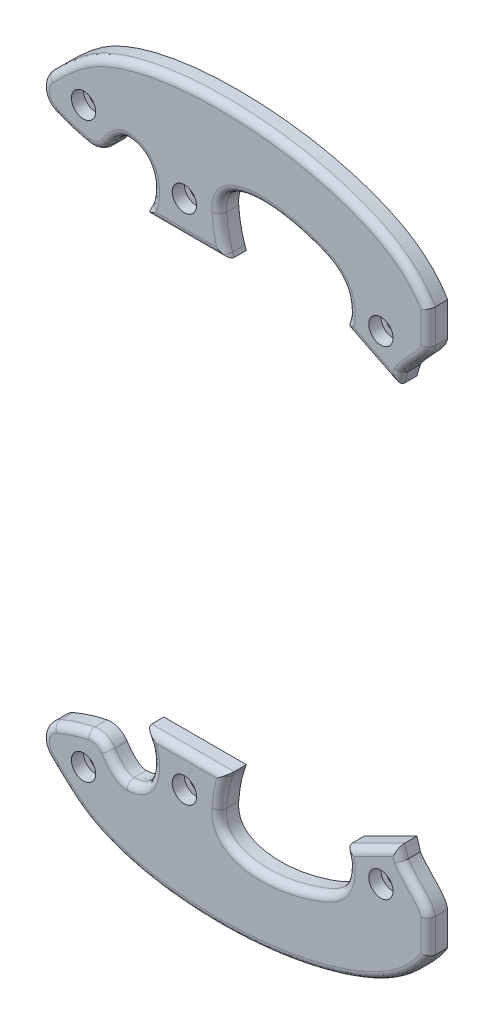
SolidWorks part; units mm, degrees
ref_plane "Front Plane" through (0, 0, 0) normal (0, 0, 1) x (1, 0, 0)
ref_plane "Top Plane" through (0, 0, 0) normal (0, 1, 0) x (1, 0, 0)
ref_plane "Right Plane" through (0, 0, 0) normal (1, 0, 0) x (0, 0, -1)
sketch "Sketch1" plane through (0, 0, 0) normal (0, 0, 1) x (1, 0, 0)
  line L8 (46.2395, -97.188) -> (45.0848, -92.6766)
  line L9 (-4.1958, -93.2842) -> (-3.553, -91.6123)
  line L10 (45.0848, -92.6766) -> (61.7915, -84.3708)
  line L11 (-31.761, -91.6123) -> (-3.553, -91.6123)
  line L12 (-31.761, -91.6123) -> (-37.5102, -91.6123)
  line L13 (-37.5102, -91.6123) -> (-35.1375, -96.6123)
  line L14 (79.2504, -115.4644) -> (79.2504, -101.6424)
  line L15 (68.0435, -86.8465) -> (66.6096, -81.9755)
  line L16 (66.6096, -81.9755) -> (61.7915, -84.3708)
  circle A0 centre (-62.5687, -117.943) radius 2.5
  circle A6 centre (59.7793, -98.549) radius 2.5
  circle A7 centre (-21.0762, -105.2979) radius 2.5
  arc A9 (-52.6376, -107.7258) -> (-60.8822, -104.3067) centre (-59.3034, -112.1493) ccw
  arc A10 (-74.8197, -108.673) -> (-77.4561, -121.5104) centre (-71.6422, -116.015) ccw
  spline S12 degree 3 poles (-4.1958, -93.2842) (-4.5548, -94.2961) (-5.1781, -96.3372) (-5.8996, -99.5536) (-6.4155, -102.8759) (-6.6342, -105.1411) (-6.7149, -106.2712) knots 0.844181 0.844181 0.844181 0.844181 0.883136 0.922091 0.961045 1 1 1 1
  spline S13 degree 3 poles (-6.7149, -106.2712) (-6.7402, -106.6253) (-6.7698, -107.3462) (-6.7331, -108.7012) (-6.5053, -110.3043) (-5.9364, -112.0151) (-5.063, -113.5348) (-3.904, -114.8555) (-2.324, -116.1074) (-0.9184, -116.8961) (0.3557, -117.4376) (1.7707, -117.9392) (3.5951, -118.4334) (6.6459, -118.9735) (10.7037, -119.2191) (15.657, -118.9333) (20.6472, -118.1868) (25.6654, -117.0431) (30.6127, -115.5522) (35.5215, -113.7684) (39.6862, -111.7117) (42.8877, -109.0511) (44.67, -106.3305) (45.6122, -103.7779) (46.0621, -101.7216) (46.2801, -99.5126) (46.2739, -97.9551) (46.2395, -97.188) knots 0 0 0 0 0.015522 0.031044 0.062088 0.093132 0.124176 0.155219 0.186263 0.217307 0.232829 0.248351 0.279395 0.310439 0.372527 0.434614 0.496702 0.55879 0.620878 0.682965 0.745053 0.807141 0.869229 0.900272 0.931316 0.96236 0.993404 0.993404 0.993404 0.993404
  spline S22 degree 3 poles (-35.1375, -96.6123) (-34.4895, -98.6761) (-34.0053, -102.0357) (-34.5537, -106.1678) (-35.5655, -108.9609) (-37.1446, -111.25) (-39.2177, -112.9391) (-41.3246, -113.8201) (-43.2063, -114.1966) (-44.2233, -114.2739) (-44.7243, -114.2851) knots 0.632471 0.632471 0.632471 0.632471 0.724353 0.770294 0.816235 0.862176 0.908118 0.954059 0.977029 1 1 1 1
  spline S23 degree 3 poles (-44.7243, -114.2851) (-45.0101, -114.2914) (-45.5611, -114.2422) (-46.8016, -113.8648) (-48.1732, -112.9957) (-49.594, -111.6551) (-50.6289, -110.4898) (-51.652, -109.1674) (-52.3183, -108.207) (-52.6376, -107.7258) knots 0 0 0 0 0.111109 0.222219 0.444438 0.555547 0.666656 0.777766 0.888875 0.888875 0.888875 0.888875
  spline S24 degree 3 poles (-60.8822, -104.3067) (-62.0784, -104.5475) (-64.4598, -105.0944) (-67.9747, -106.0966) (-71.4353, -107.2792) (-73.7005, -108.1887) (-74.8197, -108.673) knots 0.104554 0.104554 0.104554 0.104554 0.275997 0.44744 0.618884 0.790327 0.790327 0.790327 0.790327
  spline S25 degree 3 poles (-77.4561, -121.5104) (-76.2138, -122.8246) (-74.2805, -124.7513) (-71.6518, -127.1769) (-69.0526, -129.5049) (-66.2702, -131.8802) (-63.2175, -134.1302) (-59.928, -136.2642) (-55.7304, -138.4425) (-50.6441, -140.5241) (-45.4894, -142.2138) (-40.2773, -143.5891) (-35.0002, -144.7008) (-27.9955, -145.8593) (-15.7593, -147.1548) (-1.8012, -147.2823) (12.2469, -146.2151) (22.6616, -144.8081) (32.9645, -142.7692) (43.1488, -140.0168) (53.2499, -136.4138) (61.4926, -132.429) (67.7773, -128.2217) (71.4312, -125.1567) (74.1253, -122.4268) (75.7053, -120.5917) (76.9013, -119.0349) (77.6188, -118.021) (78.0999, -117.2952) (78.3744, -116.8668) (78.6267, -116.4628) (78.9027, -116.021) (79.1355, -115.6483) (79.2504, -115.4644) knots 0.024499 0.024499 0.024499 0.024499 0.055248 0.070623 0.085997 0.116746 0.132121 0.147495 0.178244 0.208993 0.239742 0.270491 0.30124 0.331989 0.393487 0.516483 0.577981 0.639479 0.700977 0.762475 0.823973 0.885471 0.91622 0.946969 0.962343 0.977718 0.985405 0.993092 0.996936 0.998858 1.000779 1.004623 1.008467 1.008467 1.008467 1.008467
  spline S26 degree 3 poles (79.2504, -101.6424) (79.2391, -101.5973) (79.2165, -101.507) (79.1825, -101.3713) (79.1543, -101.259) (79.1314, -101.1673) (79.1181, -101.1143) (79.1067, -101.0686) (79.1039, -101.0576) (79.0976, -101.0321) (79.067, -100.9136) (79.0288, -100.7799) (78.9541, -100.5438) (78.8691, -100.3124) (78.8005, -100.1448) (78.767, -100.0652) (78.7161, -99.9476) (78.6362, -99.7719) (78.4818, -99.456) (78.2777, -99.0828) (78.0458, -98.697) (77.8214, -98.3489) (77.5226, -97.9124) (77.1688, -97.432) (76.6069, -96.7153) (75.9194, -95.9073) (75.1317, -95.0308) (74.0833, -93.9067) (72.8314, -92.6059) (71.4098, -91.1047) (70.104, -89.6462) (69.1513, -88.4679) (68.4794, -87.5303) (68.1863, -87.0797) (68.0435, -86.8465) knots -0.009552 -0.009552 -0.009552 -0.009552 -0.007389 -0.005225 -0.003062 -0.00198 -0.000898 -0.000357 -0.000087 0.000048 0.000184 0.000724 0.001265 0.002347 0.003429 0.00397 0.004511 0.005592 0.007756 0.012083 0.01641 0.020737 0.025064 0.033718 0.042372 0.05968 0.076988 0.094296 0.128911 0.163527 0.198143 0.232759 0.250067 0.267375 0.267375 0.267375 0.267375
extrude "Boss-Extrude1" add sketch "Sketch1" along normal blind 8
fillet "Fillet1" radius 3 15 edges at (45.6622, -94.9323, 8) (55.8472, -87.326, 8) (67.3265, -84.411, 8) (-56.2387, -104.7596, 8) (-36.3239, -94.1123, 8) (-20.5316, -91.6123, 8) (79.2504, -108.5534, 8) (-79.4787, -114.4056, 8)
sketch "Sketch2" plane through (0, 0, 8) normal (0, 0, 1) x (1, 0, 0)
  circle A0 centre (-21.0762, -105.2979) radius 5
  circle A1 centre (59.7793, -98.549) radius 5
  circle A2 centre (-62.5687, -117.943) radius 5
extrude "Cut-Extrude1" cut sketch "Sketch2" against normal blind 5
chamfer "Chamfer1" [suppressed] distance 3 angle 45
mirror "Mirror1" about plane through (0, 0, 0) normal (0, 1, 0)
